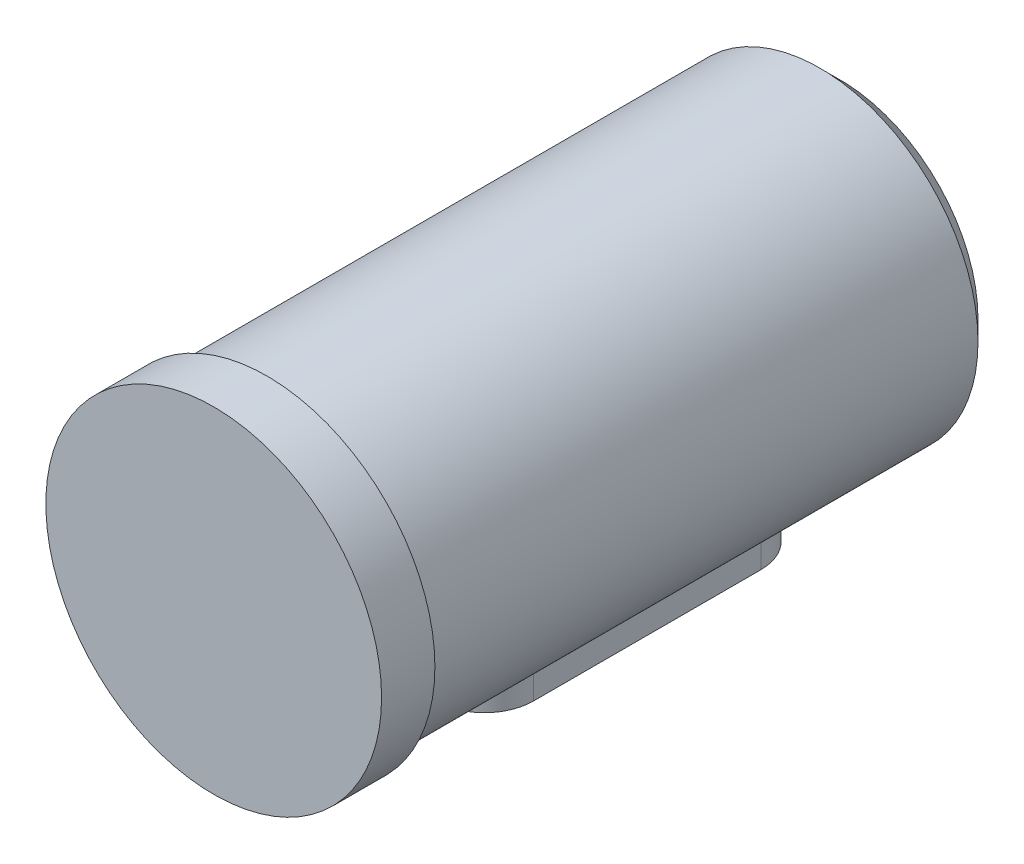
SolidWorks part; units mm, degrees
ref_plane "Face" through (0, 0, 0) normal (0, 0, 1) x (1, 0, 0)
ref_plane "Dessus" through (0, 0, 0) normal (0, 1, 0) x (1, 0, 0)
ref_plane "Droite" through (0, 0, 0) normal (1, 0, 0) x (0, 0, -1)
sketch "Esquisse1" plane through (0, 0, 0) normal (1, 0, 0) x (0, 0, -1)
  line L0 (0, 0) -> (36.7, 0) construction
  line L3 (5, 8.5) -> (5, 0)
  line L4 (5, 8.5) -> (7.7, 8.5)
  line L5 (7.7, 8.5) -> (7.7, 8)
  line L6 (7.7, 8) -> (36.7, 8)
  line L7 (36.7, 8) -> (36.7, 0)
  line L8 (5, 0) -> (36.7, 0)
  dimension "D1" = 29
  dimension "D3" = 36.7
  dimension "D5" = 16
  dimension "D6" = 17
revolve "Révolution1" add sketch "Esquisse1" angle 360 about L0
chamfer "Chanfrein1" distance 1 angle 45 1 edges at (8, 0, -36.7)
sketch "Esquisse2" plane through (0, 0, -36.7) normal (0, 0, -1) x (-1, 0, 0)
  line L0 (0, 0) -> (0, 8) construction
  circle A0 centre (0, 0) radius 8 construction
  point P0 (0, 0)
  point P1 (0, 8)
hole_wizard "Trou taraudé M6x1.01" positions "Esquisse3D1" profile "Esquisse3" tap size "M6x1.0" standard "ISO"
sketch3d "Esquisse3D1"
  point P0 (0, 0, 0)
  point P2 (0, 0, -36.7)
sketch "Esquisse3" plane through (0, 0, -36.7) normal (1, 0, 0) x (0, 1, 0)
  line L0 (0, 0) -> (0, 20.5022)
  line L1 (0, 20.5022) -> (2.5, 19)
  line L2 (2.5, 19) -> (2.5, 3.7321)
  line L3 (2.5, 3.7321) -> (3.5, 0)
  line L5 (3.5, 0) -> (0, 0)
  line L6 (-2.5, 3.7321) -> (-3.5, 0) construction
  line L10 (0, 20.5022) -> (-2.5, 19) construction
  line L11 (0, -6.35) -> (0, 107.95) construction
  dimension "Diamètre du trou pour taraudage" = 5
  dimension "Profondeur du trou pour taraudage" = 19
  dimension "Diamètre du fraisage entrant" = 7
  dimension "Angle du fraisage entrant" = 30
  dimension "Angle de pointe" = 118
ref_plane "Plan1" through (0, 8, 0) normal (0, 1, 0) x (-1, 0, 0)
ref_plane "Plan2" through (0, -10, 0) normal (0, 1, 0) x (-1, 0, 0)
sketch "Esquisse4" plane through (0, -10, 0) normal (0, 1, 0) x (-1, 0, 0)
  line L0 (-2.5, -18.7) -> (-2.5, -30.2)
  line L1 (2.5, -30.2) -> (2.5, -18.7)
  line L2 (0, -18.7) -> (0, -36.7) construction
  line L3 (-7, -36.7) -> (7, -36.7) construction
  arc A0 (-2.5, -30.2) -> (2.5, -30.2) centre (0, -30.2) ccw
  arc A1 (2.5, -18.7) -> (-2.5, -18.7) centre (0, -18.7) ccw
  dimension "D2" = 4
  dimension "D3" = 16.5
  dimension "D1" = 5
extrude "Extrusion1" add sketch "Esquisse4" along normal up to body separate body
ref_plane "Plan3" through (0, 29, 0) normal (0, 1, 0) x (-1, 0, 0)
